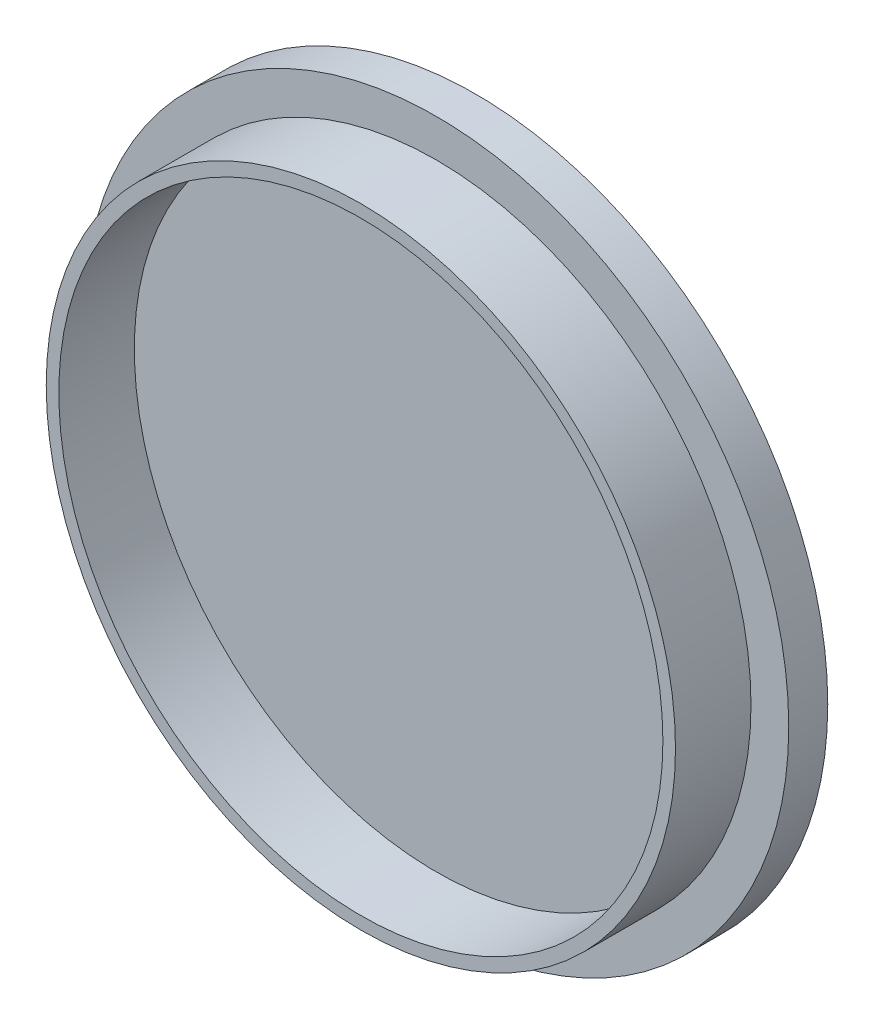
SolidWorks part; units mm, degrees
ref_plane "Plan1" through (0, 0, 0) normal (0, 0, 1) x (1, 0, 0)
ref_plane "Plan2" through (0, 0, 0) normal (0, 1, 0) x (1, 0, 0)
ref_plane "Plan3" through (0, 0, 0) normal (1, 0, 0) x (0, 0, -1)
sketch "Esquisse1" plane through (0, 0, 0) normal (0, 0, 1) x (1, 0, 0)
  circle A0 centre (0, 0) radius 28
  dimension "D1" = 56
extrude "Base-Extrusion" add sketch "Esquisse1" along normal blind 3.1
sketch "Esquisse2" plane through (0, 0, 3.1) normal (0, 0, 1) x (1, 0, 0)
  circle A0 centre (0, 0) radius 25
  circle A1 centre (0, 0) radius 24
  dimension "D1" = 50
  dimension "D2" = 48
extrude "Boss.-Extru.1" add sketch "Esquisse2" along normal blind 6
